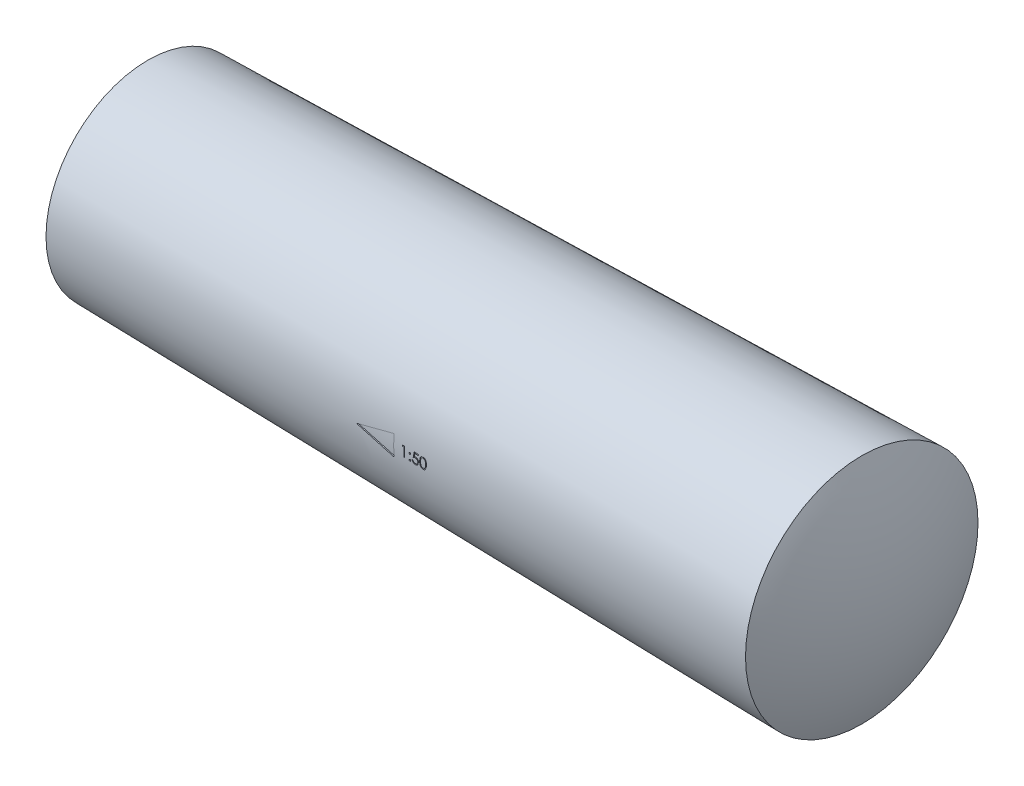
SolidWorks part; units mm, degrees
ref_plane "Front Plane" through (0, 0, 0) normal (0, 0, 1) x (1, 0, 0)
ref_plane "Top Plane" through (0, 0, 0) normal (0, 1, 0) x (1, 0, 0)
ref_plane "Right Plane" through (0, 0, 0) normal (1, 0, 0) x (0, 0, -1)
sketch "Sketch1" plane through (0, 0, 0) normal (1, 0, 0) x (0, 0, -1)
  circle A0 centre (0, 0) radius 10
  dimension "D1" = 20
extrude "Extrude1" add sketch "Sketch1" along normal mid plane 70
draft "Draft1" type of draft neutral plane draft angle 1.146 faces to draft 1 parameters "D1"=1.146
sketch "Sketch2" plane through (0, 0, 0) normal (0, 0, 1) x (1, 0, 0)
  line L0 (-35, 0) -> (-35, 10)
  line L1 (-35, 10) -> (-35, -10) construction
  line L2 (-35, 0) -> (-37.5, 0)
  line L3 (-37.5, 0) -> (-37.5, -10.7) construction
  line L4 (35, 0) -> (35, 11.4)
  line L5 (35, -11.4) -> (35, 11.4) construction
  line L6 (35, 0) -> (37.5, 0)
  line L7 (37.5, 0) -> (37.5, -10.7) construction
  line L8 (-35, -10) -> (35, -11.4) construction
  arc A0 (-37.5, 0) -> (-35, 10) centre (-16.25, 0) cw
  arc A1 (37.5, 0) -> (35, 11.4) centre (10.2578, 0) ccw
  point P14 (0, -10.7)
revolve "Revolve1" add sketch "Sketch2" angle 360 about L2
sketch "Sketch5" plane through (0, 0, 0) normal (0, 0, 1) x (1, 0, 0)
  line L0 (0, 10.7) -> (0, -10.7) construction
  line L1 (35, 11.4) -> (-35, 10) construction
  line L2 (-35, -10) -> (35, -11.4) construction
ref_plane "Plane2" through (0, 0, 0) normal (-0.02, 0, 0.9998) x (0.9998, 0, 0.02)
sketch "Sketch6" plane through (0, 0, 0) normal (-0.02, 0, 0.9998) x (0.9998, 0, 0.02)
  line L0 (0, 0) -> (0, 1)
  line L1 (0, 10.7) -> (0, -10.7) construction
  line L2 (0, 1) -> (-3.7321, 0)
  line L3 (-3.7321, 0) -> (0, -1)
  line L4 (0, -1) -> (0, 0)
  line L5 (0, -0.5) -> (4, -0.5) construction
  text T0 "1:50" font "Century Gothic" height 1
  dimension "D1" = 2
  dimension "D2" = 30
  dimension "D3" = 4
wrap "Wrap2" sketch "Sketch6" wrap type deboss source sketch "Sketch6" thickness 0.1 parameters "D1"=0.1
equation "\"D2@Sketch2\" = \"D1@Sketch2\""
